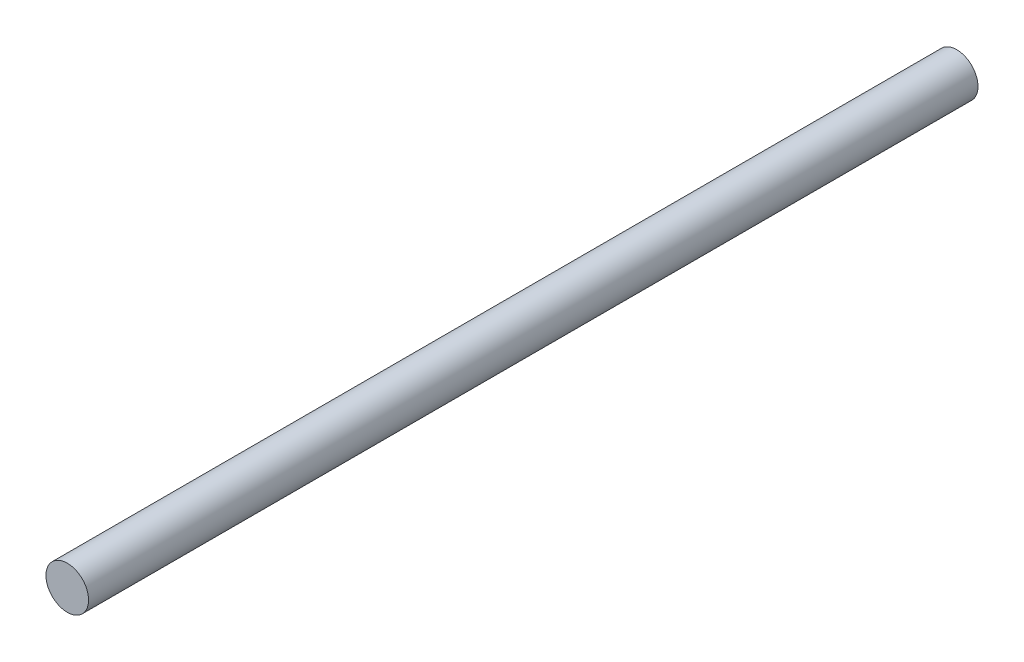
SolidWorks part; units mm, degrees
ref_plane "Plane1" through (0, 0, 0) normal (0, 0, 1) x (1, 0, 0)
ref_plane "Plane2" through (0, 0, 0) normal (0, 1, 0) x (1, 0, 0)
ref_plane "Plane3" through (0, 0, 0) normal (1, 0, 0) x (0, 0, -1)
sketch "Sketch1"
  dimension "D1" = 36.5125
extrude "Base-Extrude" add sketch "Sketch1" along normal mid plane 762
